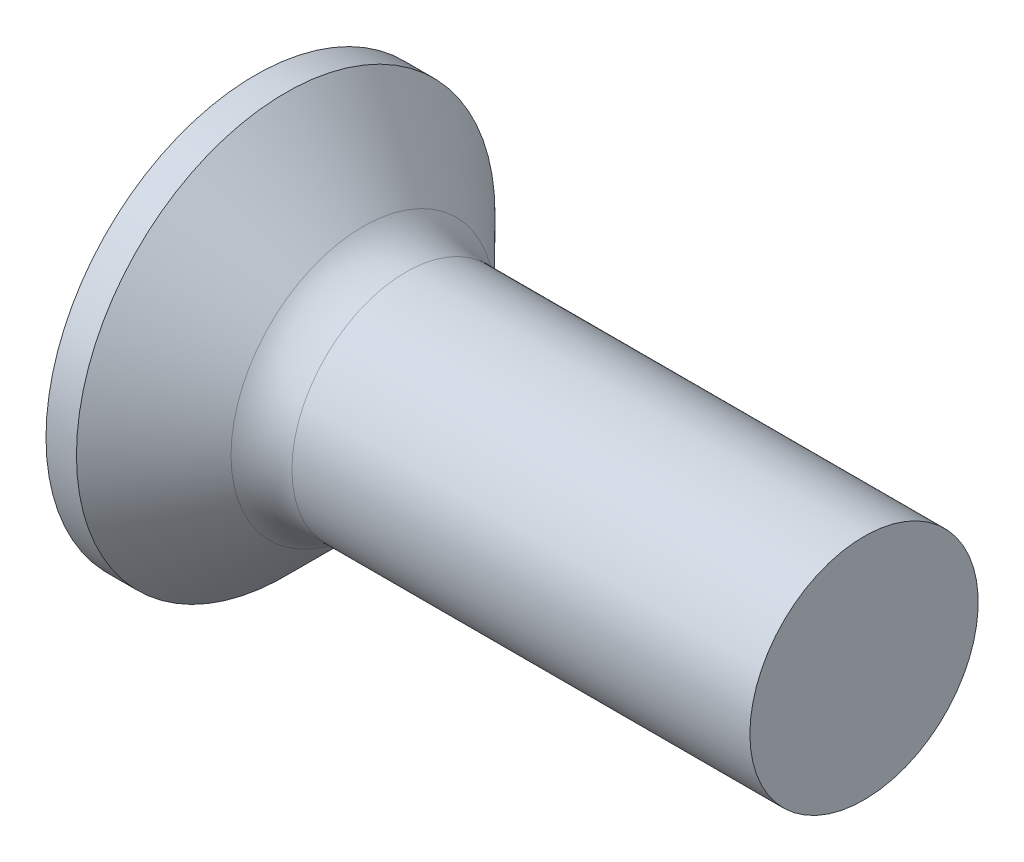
SolidWorks part; units mm, degrees
ref_plane "Plane1" through (0, 0, 0) normal (0, 0, 1) x (1, 0, 0)
ref_plane "Plane2" through (0, 0, 0) normal (0, 1, 0) x (1, 0, 0)
ref_plane "Plane3" through (0, 0, 0) normal (1, 0, 0) x (0, 0, -1)
sketch "BodySke" plane through (0, 0, 0) normal (0, 0, 1) x (1, 0, 0)
  line L0 (0, 0) -> (0, 2.75)
  line L1 (0, 2.75) -> (0.4, 2.75)
  line L2 (1.65, 1.5) -> (8, 1.5)
  line L3 (8, 1.5) -> (8, 0)
  line L4 (8, 0) -> (0, 0)
  line L5 (-6.35, 0) -> (82.55, 0) construction
  line L6 (1.65, -1.5) -> (8, -1.5) construction
  line L7 (0.4, -2.75) -> (1.65, -1.5) construction
  line L8 (0.4, 2.75) -> (1.65, 1.5)
  line L9 (0, -2.75) -> (0.4, -2.75) construction
  line L10 (2.15, 3.0875) -> (2.15, -6.4375) construction
  line L11 (0, 6.35) -> (0, -3.175) construction
  dimension "Diameter" = 3
  dimension "Length" = 8
  dimension "Head_ht" = 1.65
  dimension "Head_dia" = 5.5
  dimension "Head_ang" = 90
  dimension "D6" = 0.4
  dimension "Advance" = 0.5
  dimension "Thread_nom" = 8
revolve "Base-Revolve" add sketch "BodySke" angle 360 about L5
fillet "Fillet1" radius 0.8 1 edges at (1.65, 0, 1.5)
sketch "Sketch3" plane through (0, 0, 0) normal (-1, 0, 0) x (0, 0, 1)
  line L0 (-0.37, 1.5) -> (0.37, 1.5)
  line L1 (0.37, 1.5) -> (0.37, -1.5)
  line L2 (0.37, -1.5) -> (-0.37, -1.5)
  line L3 (-0.37, -1.5) -> (-0.37, 1.5)
  dimension "D1" = 1.5
  dimension "Cross_dia" = 3
  dimension "D2" = 0.37
  dimension "Cross_width" = 0.74
ref_plane "Plane4" through (2.01, 0, 0) normal (-1, 0, 0) x (0, 0, 1)
sketch "Sketch4" plane through (2.01, 0, 0) normal (-1, 0, 0) x (0, 0, 1)
  line L0 (-0.37, 0.4979) -> (0.37, 0.4979)
  line L3 (0.37, 0.4979) -> (0.37, -0.4979)
  line L4 (0.37, -0.4979) -> (-0.37, -0.4979)
  line L5 (-0.37, -0.4979) -> (-0.37, 0.4979)
  dimension "D1" = 0.74
  dimension "D2" = 0.9957
  dimension "D3" = 0.37
  dimension "D4" = 0.4979
loft "Recess" cut profiles "Sketch3", "Sketch4"
pattern_circular "RecPat" count 2 every 90 about axis through (0, 0, 0) along (1, 0, 0) of "Recess"
sketch "RecCorSke" plane through (0, 0, 0) normal (0, 0, 1) x (1, 0, 0)
  line L0 (-3.175, 0) -> (15.875, 0) construction
  line L2 (0, 0) -> (0, 0.6966)
  line L3 (0, 0.6966) -> (2.01, 0.556)
  line L4 (2.01, 0.556) -> (2.1907, 0)
  line L5 (2.1907, 0) -> (0, 0)
  dimension "Diameter" = 1.112
  dimension "Depth" = 2.01
  dimension "Draft_angle" = 4
  dimension "Bottom_angle" = 18
revolve "RecessCore" cut sketch "RecCorSke" angle 360 about L0
sketch "ThdSchSke" plane through (0, 0, 0) normal (0, 0, 1) x (1, 0, 0)
  line L0 (2.15, -1.2195) -> (1.9536, -1.5)
  line L1 (2.15, -1.2195) -> (2.3464, -1.5)
  line L2 (2.3464, -1.5) -> (2.3464, -1.875)
  line L3 (-3.175, 0) -> (5.1513, 0) construction
  line L5 (2.3464, -1.875) -> (1.9536, -1.875)
  line L6 (1.9536, -1.875) -> (1.9536, -1.5)
  line L7 (0, 2.75) -> (0, -2.75) construction
  dimension "Thread_minor" = 2.439
  dimension "Diameter" = 3
  dimension "Start" = 2.15
  dimension "SideAngle" = 55
  dimension "VeeAngle" = 70
  dimension "Overcut" = 3.75
revolve "ThreadSchematic" [suppressed] cut sketch "ThdSchSke" angle 360 about L3
pattern_linear "ThdSchPat" [suppressed]
equation "\"D1@Sketch3\" = \"Cross_dia@Sketch3\" / 2"
equation "\"D2@Sketch3\" = \"Cross_width@Sketch3\" / 2"
equation "\"Depth@RecCorSke\" = \"Cross_depth@Plane4\""
equation "\"D1@Sketch4\" = \"Cross_width@Sketch3\""
equation "\"D2@Sketch4\" = \"Cross_dia@Sketch3\" - 2.0 * \"Cross_depth@Plane4\" * tan(26.5  * 0.017453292)"
equation "\"D3@Sketch4\" = \"D1@Sketch4\" / 2"
equation "\"D4@Sketch4\" = \"D2@Sketch4\" / 2"
equation "\"Thread_length@ThreadCosmetic\" = ((sgn( (\"Length@BodySke\" - \"Advance@BodySke\" * 1.0 - \"Head_ht@BodySke\" ) - \"Thread_nom@BodySke\" )-1)*( (\"Length@BodySke\" - \"Advance@BodySke\" * 1.0 - \"Head_ht@BodySke\" "
equation "\"Thread_minor@ThdSchSke\" = \"Thread_minor@ThreadCosmetic\""
equation "\"Diameter@ThdSchSke\" = \"Diameter@BodySke\""
equation "\"Overcut@ThdSchSke\" = \"Diameter@BodySke\" * 1.25"
equation "\"Start@ThdSchSke\" = 0.000001 + \"Length@BodySke\" - \"Thread_length@ThreadCosmetic\"  '---Countersunk---"
equation "\"Num_threads@ThdSchPat\" = int( \"Thread_length@ThreadCosmetic\" / \"Advance@BodySke\" + 0.999 )  + 1"
equation "\"Advance@ThdSchPat\" = \"Thread_length@ThreadCosmetic\" /  (\"Num_threads@ThdSchPat\" - 1) 'relax it"
